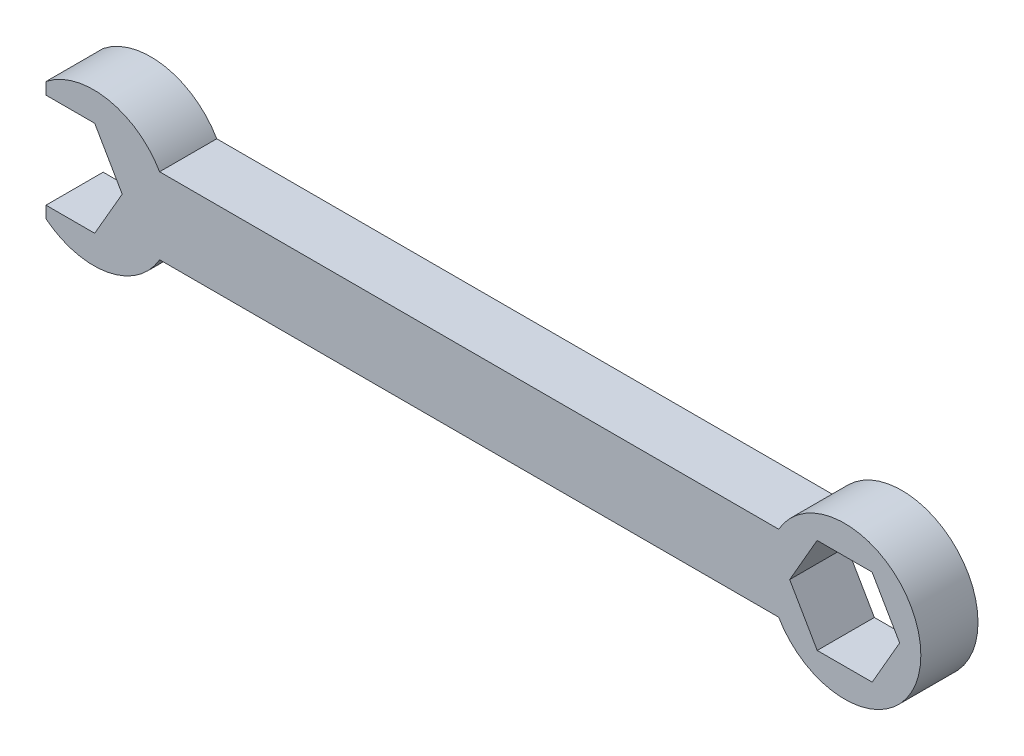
SolidWorks part; units mm, degrees
ref_plane "Front Plane" through (0, 0, 0) normal (0, 0, 1) x (1, 0, 0)
ref_plane "Top Plane" through (0, 0, 0) normal (0, 1, 0) x (1, 0, 0)
ref_plane "Right Plane" through (0, 0, 0) normal (1, 0, 0) x (0, 0, -1)
sketch "Sketch1" plane through (0, 0, 0) normal (0, 0, 1) x (1, 0, 0)
  line L0 (-3.81, 12.8345) -> (-3.81, -12.7779) construction
  line L2 (-10.16, -6.35) -> (-3.6662, -6.35)
  line L3 (-3.6662, -6.35) -> (0, 0)
  line L4 (0, 0) -> (-3.6662, 6.35)
  line L5 (-3.6662, 6.35) -> (-10.16, 6.35)
  line L7 (-24.0598, 0) -> (116.8395, 0) construction
  line L8 (-10.16, 6.35) -> (-10.16, 7.9311)
  line L9 (-10.16, -6.35) -> (-10.16, -7.9311)
  line L10 (-13.8783, 1.3621) -> (-14.6647, 0)
  line L11 (-12.8316, -3.175) -> (-10.9985, -6.35)
  line L12 (4.9888, 5.08) -> (87.5388, 5.08)
  line L13 (4.9888, -5.08) -> (87.5388, -5.08)
  line L14 (9.9907, 5.08) -> (9.9907, -5.08) construction
  line L16 (103.67, 0.0069) -> (99.9979, 6.3534)
  line L17 (99.9979, 6.3534) -> (92.6655, 6.3466)
  line L18 (92.6655, 6.3466) -> (89.0053, -0.0069)
  line L19 (89.0053, -0.0069) -> (92.6774, -6.3534)
  line L20 (92.6774, -6.3534) -> (100.0098, -6.3466)
  line L21 (100.0098, -6.3466) -> (103.67, 0.0069)
  circle A0 centre (-7.3323, 0) radius 6.35 construction
  arc A2 (-10.16, -7.9311) -> (4.9888, -5.08) centre (-3.81, 0) ccw
  arc A3 (4.9888, 5.08) -> (-10.16, 7.9311) centre (-3.81, 0) ccw
  arc A4 (87.5388, -5.08) -> (87.5388, 5.08) centre (96.3376, 0) ccw
  circle A5 centre (96.3376, 0) radius 6.35 construction
  point P25 (9.9907, 0)
  point P26 (98.2844, 0)
  point P28 (-47.3498, 0.843)
  point P29 (98.2844, -0.0069)
  point P37 (97.2248, 0.0069)
  point P38 (0, 0)
  point P39 (0, 0)
  dimension "D1" = 10.16
  dimension "D2" = 82.55
  dimension "D5" = 12.7
  dimension "D6" = 10.16
  dimension "D7" = 10.16
  dimension "D3" = 12.7
  dimension "D4" = 6.35
extrude "Boss-Extrude2" add sketch "Sketch1" against normal blind 7.62
